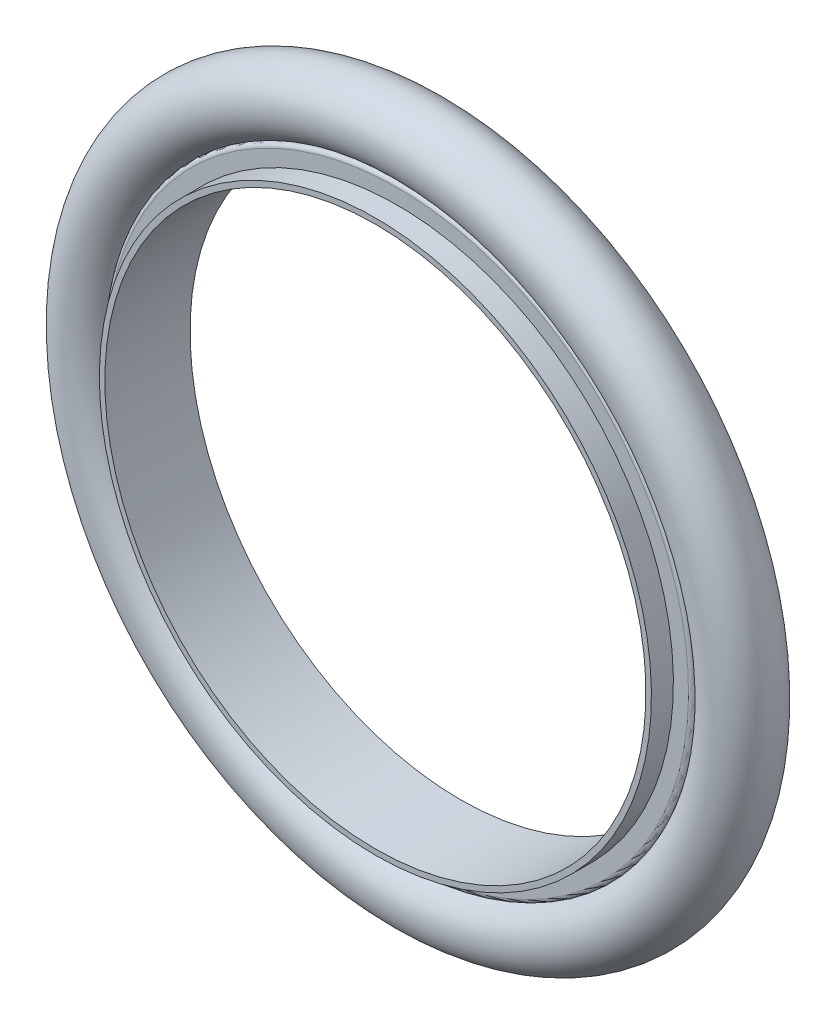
SolidWorks part; units mm, degrees
ref_plane "Front Plane" through (0, 0, 0) normal (0, 0, 1) x (1, 0, 0)
ref_plane "Top Plane" through (0, 0, 0) normal (0, 1, 0) x (1, 0, 0)
ref_plane "Right Plane" through (0, 0, 0) normal (1, 0, 0) x (0, 0, -1)
sketch "Sketch1" plane through (0, 0, 0) normal (1, 0, 0) x (0, 0, -1)
  line L0 (0, 0) -> (0, 29.9874) construction
  line L1 (-3.937, 0) -> (3.937, 0) construction
  line L2 (-3.937, 25.0063) -> (3.937, 25.0063) construction
  line L3 (-3.937, 25.0063) -> (-3.937, 25.5143) construction
  line L4 (-3.937, 25.5143) -> (-1.905, 25.5143) construction
  line L5 (-1.905, 25.5143) -> (-1.905, 26.9113) construction
  line L6 (-1.524, 27.2923) -> (1.524, 27.2923) construction
  line L7 (1.905, 25.5143) -> (1.905, 26.9113) construction
  line L8 (3.937, 25.5143) -> (1.905, 25.5143) construction
  line L9 (3.937, 25.0063) -> (3.937, 25.5143) construction
  line L10 (-3.937, 37.465) -> (-3.937, -37.465) construction
  line L11 (3.937, 25.0063) -> (3.937, -25.0063) construction
  line L12 (-3.937, -25.4) -> (-3.937, 25.4)
  circle A0 centre (0, 29.9874) radius 3.0961 construction
  arc A1 (-1.905, 26.9113) -> (-1.524, 27.2923) centre (-1.524, 26.9113) cw construction
  arc A2 (1.905, 26.9113) -> (1.524, 27.2923) centre (1.524, 26.9113) ccw construction
  point P7 (0, 0)
  point P10 (0, 25.0063)
  point P23 (-3.937, 0)
  point P26 (3.937, 0)
  point P31 (-3.937, 0)
  dimension "D3" = 0.381
  dimension "Ring OD" = 66.167
  dimension "Length" = 7.874
  dimension "For Tube OD" = 50.8
  dimension "D2" = 2.286
  dimension "D4" = 3.81
  dimension "For Flange OD" = 74.93
  dimension "Wall Thichness" = 0.508
  dimension "ID" = 50.0126
sketch "Sketch4" plane through (0, 0, 0) normal (0, 0, 1) x (1, 0, 0)
  circle A0 centre (0, 0) radius 37.465 construction
  circle A1 centre (0, 0) radius 25.4 construction
sketch "Sketch2" plane through (0, 0, 0) normal (1, 0, 0) x (0, 0, -1)
  line L0 (-1.905, 25.5143) -> (-1.905, 26.9113) construction
  line L1 (-1.905, 25.5143) -> (-1.905, 26.9113)
  line L2 (-3.937, 25.5143) -> (-1.905, 25.5143) construction
  line L3 (-3.937, 25.5143) -> (-1.905, 25.5143)
  line L4 (-3.937, 25.0063) -> (-3.937, 25.5143) construction
  line L5 (-3.937, 25.0063) -> (-3.937, 25.5143)
  line L6 (-3.937, 25.0063) -> (3.937, 25.0063) construction
  line L7 (-3.937, 25.0063) -> (3.937, 25.0063)
  line L8 (3.937, 25.0063) -> (3.937, 25.5143) construction
  line L9 (3.937, 25.0063) -> (3.937, 25.5143)
  line L10 (3.937, 25.5143) -> (1.905, 25.5143) construction
  line L11 (3.937, 25.5143) -> (1.905, 25.5143)
  line L12 (1.905, 25.5143) -> (1.905, 26.9113) construction
  line L13 (1.905, 25.5143) -> (1.905, 26.9113)
  arc A2 (-1.524, 27.2923) -> (-1.905, 26.9113) centre (-1.524, 26.9113) ccw construction
  arc A3 (-1.524, 27.2923) -> (-1.905, 26.9113) centre (-1.524, 26.9113) ccw
  arc A4 (1.905, 26.9113) -> (1.524, 27.2923) centre (1.524, 26.9113) ccw construction
  arc A5 (1.905, 26.9113) -> (1.524, 27.2923) centre (1.524, 26.9113) ccw
  circle A6 centre (0, 29.9874) radius 3.0961 construction
  arc A7 (-1.524, 27.2923) -> (1.524, 27.2923) centre (0, 29.9874) ccw
revolve "Revolve1" add sketch "Sketch2" angle 360 about L1
sketch "Sketch3" plane through (0, 0, 0) normal (1, 0, 0) x (0, 0, -1)
  circle A0 centre (0, 29.9874) radius 3.0961 construction
  circle A1 centre (0, 29.9874) radius 3.0961
revolve "Revolve2" add sketch "Sketch3" angle 360 about L1
